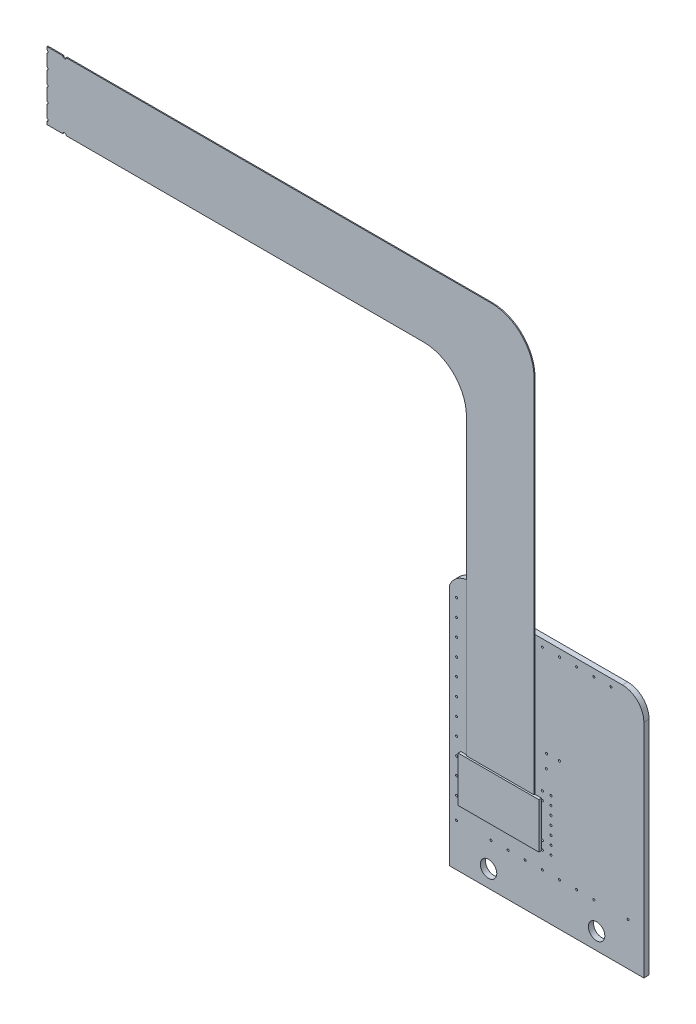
SolidWorks part; units mm, degrees
other "<100221168ra_esp_3g_flexboard>-<100221168ra_esp_3g_flexboard_idf-1-solid1>"
ref_plane "Front Plane" through (0, 0, 0) normal (0, 0, 1) x (1, 0, 0)
ref_plane "Top Plane" through (0, 0, 0) normal (0, 1, 0) x (1, 0, 0)
ref_plane "Right Plane" through (0, 0, 0) normal (1, 0, 0) x (0, 0, -1)
imported_body "100221166rc_esp_3gheaterboard-1-solid1"
imported_body "MBARI_ESPHEATERFLEXSMD2_7P_CON12_1_MBARI_ESPHEATERFLEXSMD-1-solid1"
imported_body "TRXDFN62X62X423N_MMBT3904FZ7B-1-solid1"
sketch "Sketch1" plane through (0, 0, 0) normal (0, 0, -1) x (-1, 0, 0)
  line L0 (0, 0) -> (-28.746, 0) construction
  line L1 (-26.162, 4.572) -> (-2.54, 4.572)
  line L2 (-26.162, 4.572) -> (-26.162, 0)
  line L3 (-26.162, 0) -> (-2.54, 0)
  line L4 (-2.54, 4.572) -> (-2.54, 0)
  line L5 (0, 36.0693) -> (0, 0) construction
  line L6 (0, 36.0693) -> (0, 0) construction
  line L7 (0, 0) -> (-28.746, 0) construction
  circle A0 centre (-21.746, 2.5) radius 1.2192 construction
  circle A1 centre (-21.746, 2.5) radius 1.2192
  circle A2 centre (-5.746, 2.5) radius 1.2192 construction
  circle A3 centre (-5.746, 2.5) radius 1.2192
  circle A4 centre (-14.986, 12.7) radius 0.1524 construction
  circle A5 centre (-14.986, 11.43) radius 0.1524 construction
  dimension "D1" = 4.572
  dimension "D2" = 23.622
  dimension "D3" = 2.54
  dimension "D4" = 5.746
  dimension "D5" = 2.5
extrude "Boss-Extrude1" [suppressed] add sketch "Sketch1" along normal blind 0.508
inserted part "LnG5_100221168ra_esp_3g_flexboard"
move or copy body "Body-Move/Copy2" placed by mates yes
other "Distance1" parameters "D1"=65.405
other "Distance2" parameters "D1"=0.9712
sketch "Sketch2" plane through (0, 0, 0) normal (1, 0, 0) x (0, 0, -1)
  line L0 (-2.7747, 8.775) -> (-0.7747, 8.775) construction
  line L1 (-2.7747, 15.5) -> (-1.1735, 15.5)
  line L2 (-2.7747, 15.5) -> (-2.7747, 8.775)
  line L3 (-2.7747, 8.775) -> (-1.1735, 8.775)
  line L4 (-1.1735, 15.5) -> (-1.1735, 8.775)
  line L5 (-0.9195, 12.6822) -> (-0.9195, 59.055) construction
  dimension "D1" = 0.254
extrude "Cut-Extrude1" cut sketch "Sketch2" against normal through all both and the other way through all
sketch "Sketch3" [suppressed] plane through (0, 0, 0) normal (0, 0, -1) x (-1, 0, 0)
  line L0 (-11.7424, 36.0013) -> (0, 36.0013)
  line L5 (-28.746, 0) -> (0, 0)
  line L6 (0, 0) -> (0, 36.0693)
  line L7 (-2.921, 38) -> (-8.2964, 38)
  line L8 (-11.7424, 36.0013) -> (-25.571, 36.0013)
  line L9 (-28.746, 32.8263) -> (-28.746, 0)
  line L11 (0, 36.0013) -> (0, 36.0693)
  line L12 (-2.921, 38) -> (-8.2964, 38)
  arc A4 (0, 36.0693) -> (-2.921, 38) centre (-2.921, 34.825) ccw
  arc A5 (-8.2964, 38) -> (-11.0532, 36.4) centre (-8.2964, 34.825) ccw
  arc A6 (-11.7424, 36.0013) -> (-11.0532, 36.4) centre (-11.7439, 36.7987) ccw
  arc A7 (-25.571, 36.0013) -> (-28.746, 32.8263) centre (-25.571, 32.8263) ccw
  arc A8 (0, 36.0693) -> (-2.921, 38) centre (-2.921, 34.825) ccw
  arc A9 (-8.2964, 38) -> (-11.0532, 36.4) centre (-8.2964, 34.825) ccw
  arc A10 (-11.7424, 36.0013) -> (-11.0532, 36.4) centre (-11.7439, 36.7987) ccw
  dimension "D1" = 0
extrude "Cut-Extrude2" [suppressed] cut sketch "Sketch3" against normal up to next
